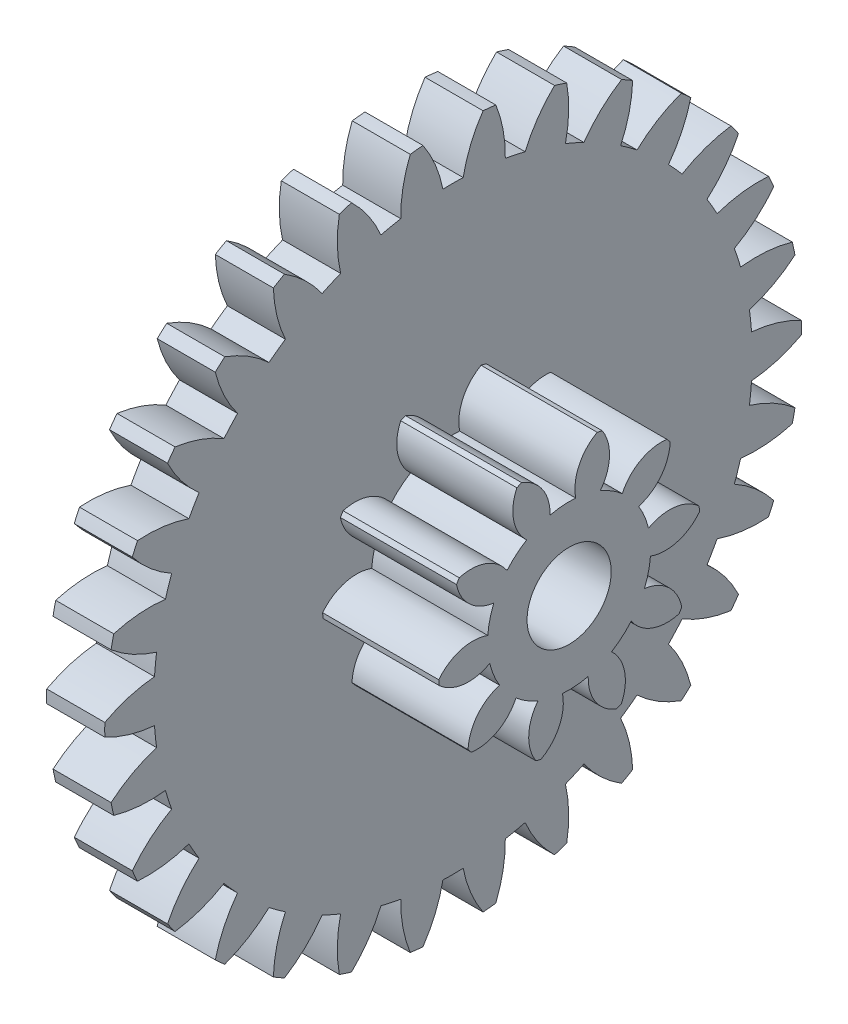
SolidWorks part; units mm, degrees
ref_plane "Alzado" through (0, 0, 0) normal (0, 0, 1) x (1, 0, 0)
ref_plane "Planta" through (0, 0, 0) normal (0, 1, 0) x (1, 0, 0)
ref_plane "Vista lateral" through (0, 0, 0) normal (1, 0, 0) x (0, 0, -1)
imported_body "spur gear_din-1-solid1"
imported_body "spur gear_din-2-solid1"
sketch "Croquis1" plane through (0.1296, 0, 0) normal (1, 0, 0) x (0, 0, -1)
  circle A0 centre (0, 0.9184) radius 1.45
  dimension "D1" = 2.9
extrude "Cortar-Extruir1" cut sketch "Croquis1" against normal through all both and the other way through all
